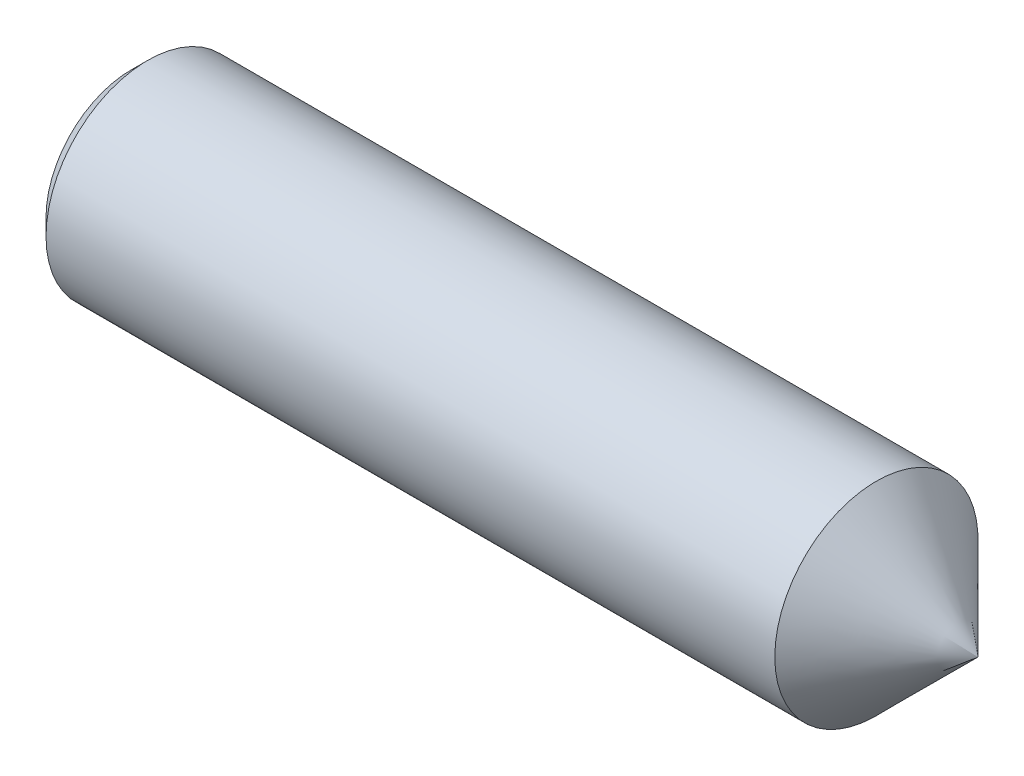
SolidWorks part; units mm, degrees
ref_plane "Front Plane" through (0, 0, 0) normal (0, 0, 1) x (1, 0, 0)
ref_plane "Top Plane" through (0, 0, 0) normal (0, 1, 0) x (1, 0, 0)
ref_plane "Right Plane" through (0, 0, 0) normal (1, 0, 0) x (0, 0, -1)
sketch "BodySke" plane through (0, 0, 0) normal (0, 0, 1) x (1, 0, 0)
  line L0 (0, 0) -> (88.3411, 0) construction
  line L1 (0, 0) -> (0, 5.036)
  line L2 (0, 5.036) -> (0.964, 6)
  line L3 (0.964, 6) -> (44.0005, 6)
  line L4 (50, 0.0005) -> (44.0005, 6)
  line L5 (50, 0.0005) -> (50, 0)
  line L6 (50, 0) -> (0, 0)
  line L7 (1.75, 0) -> (1.75, 8.5388) construction
  line L8 (0, -5.036) -> (0.964, -6) construction
  line L9 (50, -0.0005) -> (44.0005, -6) construction
  dimension "Diameter" = 12
  dimension "Thread_minor" = 10.072
  dimension "Length" = 50
  dimension "Cone_dia" = 0.001
  dimension "Drive_chamfer_angle" = 90
  dimension "Advance" = 1.75
  dimension "Cone_angle" = 90
revolve "BaseBody" add sketch "BodySke" angle 360 about L0
sketch "CountersinkSke" plane through (0, 0, 0) normal (1, 0, 0) x (0, 0, -1)
  line L1 (0, 3.4641) -> (-3, 1.7321)
  line L2 (-3, 1.7321) -> (-3, -1.7321)
  line L3 (-3, -1.7321) -> (0, -3.4641)
  line L4 (0, -3.4641) -> (3, -1.7321)
  line L5 (3, -1.7321) -> (3, 1.7321)
  line L6 (3, 1.7321) -> (0, 3.4641)
  circle A0 centre (0, 0) radius 3 construction
  dimension "Countersink_width" = 6
extrude "Countersink" cut sketch "CountersinkSke" along normal blind 8
sketch "ThdSchSke" plane through (0, 0, 0) normal (0, 0, 1) x (1, 0, 0)
  line L0 (0, 0) -> (53.6961, 0) construction
  line L1 (1.6009, 7.1131) -> (1.6009, 6)
  line L2 (1.6009, 7.1131) -> (2.714, 7.1131)
  line L3 (2.714, 7.1131) -> (2.714, 6)
  line L4 (2.714, 6) -> (2.1574, 5.036)
  line L5 (2.1574, 5.036) -> (1.6009, 6)
  line L7 (0.964, 6) -> (0.964, -6) construction
  dimension "D1" = 1.75
revolve "ThreadSchematic" [suppressed] cut sketch "ThdSchSke" angle 360 about L0
pattern_linear "ThdSchPat" [suppressed]
equation "\"Thread_minor@ThreadCosmetic\" = \"Thread_minor@BodySke\""
equation "\"D1@ThdSchSke\" = \"Advance@BodySke\" "
equation "\"Advance@ThdSchPat\" = \"Advance@BodySke\""
equation "\"Tooth_Num@ThdSchPat\" =  int(  ( \"Length@BodySke\" -  ( \"Diameter@BodySke\" - \"Thread_minor@BodySke\" )  / 2 /  tan( \"Drive_chamfer_angle@BodySke\" / 2 )  -  \"Diameter@BodySke\" / 2 *  sin( \"Cone_angle@Bod"
